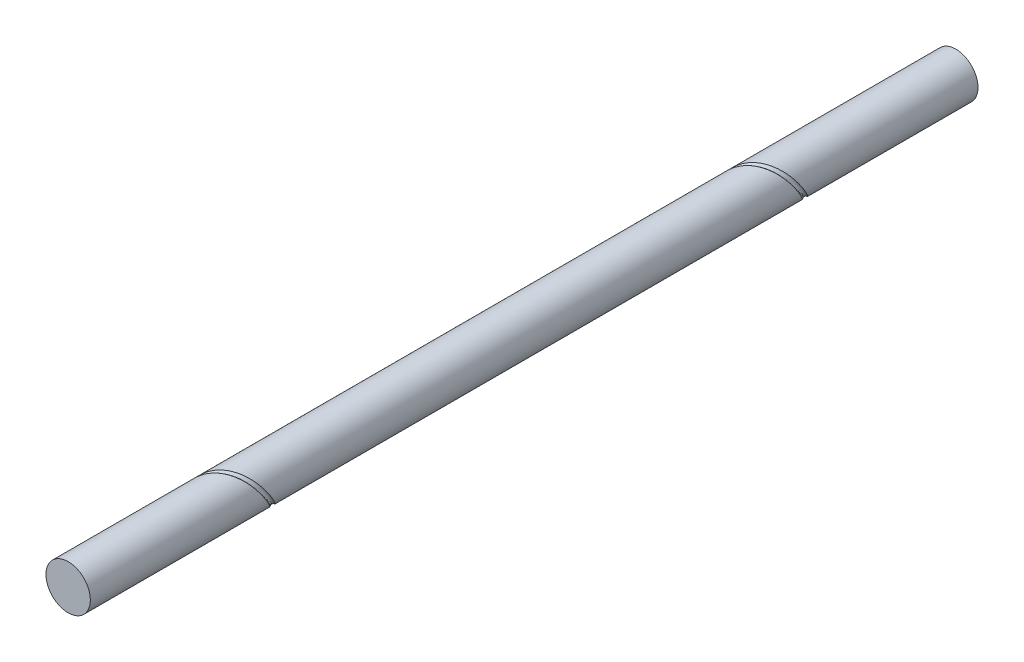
SolidWorks part; units mm, degrees
ref_plane "Front Plane" through (0, 0, 0) normal (0, 0, 1) x (1, 0, 0)
ref_plane "Top Plane" through (0, 0, 0) normal (0, 1, 0) x (1, 0, 0)
ref_plane "Right Plane" through (0, 0, 0) normal (1, 0, 0) x (0, 0, -1)
sketch "Sketch1" plane through (0, 0, 0) normal (0, 0, 1) x (1, 0, 0)
  circle A0 centre (0, 0) radius 25
  dimension "D1" = 50
extrude "Boss-Extrude1" add sketch "Sketch1" along normal blind 1000
ref_plane "Plane1" through (0, 0, 150) normal (0, 0, 1) x (1, 0, 0)
sketch "Sketch2" plane through (0, 0, 150) normal (0, 0, 1) x (1, 0, 0)
  circle A0 centre (0, 0) radius 27.646
  dimension "D1" = 55.292
curve "Helix/Spiral1"
sketch "Sketch3" plane through (0, 0, 0) normal (0, 1, 0) x (1, 0, 0)
  circle A0 centre (-27.646, -150) radius 3.969
  spline S0 degree 3 poles (-27.646, -150) (-27.646, -151.3307) (-27.0608, -154.0012) (-24.4828, -157.9997) (-20.3663, -162.0001) (-14.9702, -166) (-8.6335, -170) (-1.7543, -174) (5.2352, -178) (11.8957, -182) (17.8087, -186) (22.6028, -190) (25.9766, -194) (27.7183, -198) (27.7183, -202) (25.9766, -206) (22.6028, -210) (17.8087, -214) (11.8957, -218) (5.2352, -222) (-1.7543, -226) (-8.6335, -230) (-14.9702, -234) (-20.3663, -237.9999) (-24.4828, -242.0003) (-27.0608, -245.9988) (-27.646, -248.6693) (-27.646, -250) knots 0 0 0 0 0.04 0.08 0.12 0.16 0.2 0.24 0.28 0.32 0.36 0.4 0.44 0.48 0.52 0.56 0.6 0.64 0.68 0.72 0.76 0.8 0.84 0.88 0.92 0.96 1 1 1 1 construction
  dimension "D1" = 7.938
sweep "Cut-Sweep1" cut profiles "Sketch3" path "Helix/Spiral1"
pattern_linear "LPattern1" count 2 spacing 600 along (0, 0, -1) of "Cut-Sweep1"
